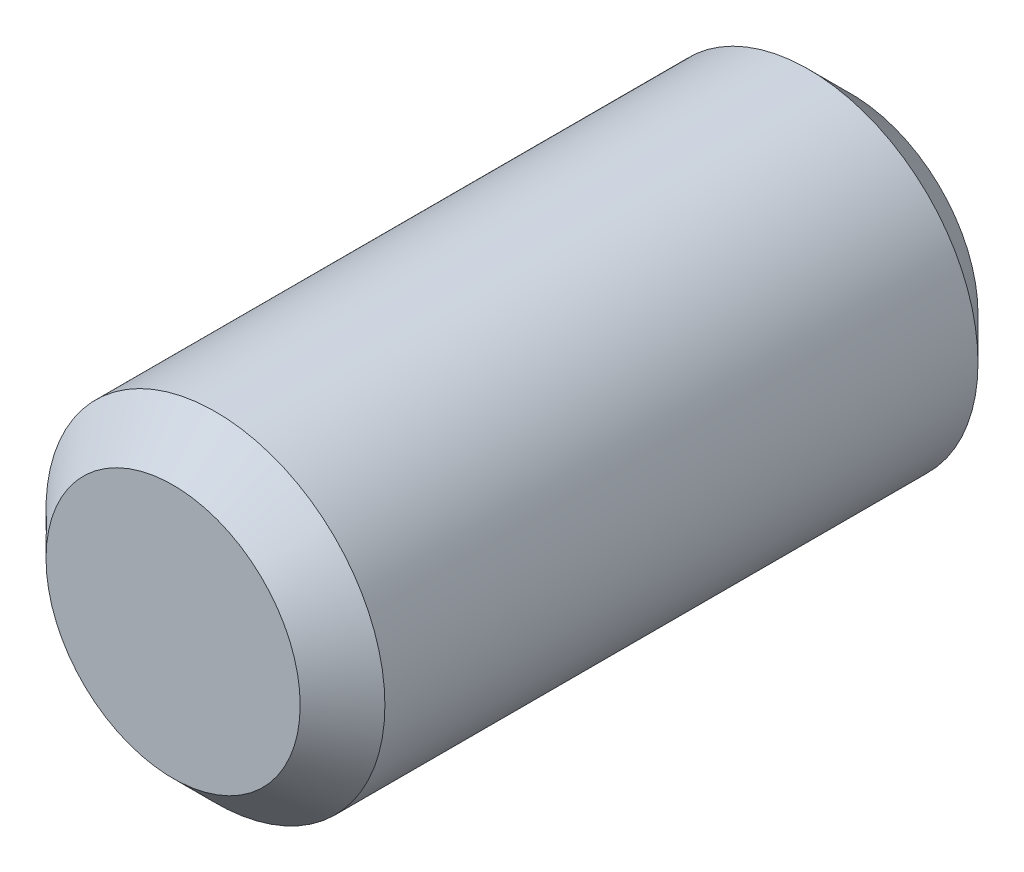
SolidWorks part; units mm, degrees
ref_plane "Plan de face" through (0, 0, 0) normal (0, 0, 1) x (1, 0, 0)
ref_plane "Plan de dessus" through (0, 0, 0) normal (0, 1, 0) x (1, 0, 0)
ref_plane "Plan de droite" through (0, 0, 0) normal (1, 0, 0) x (0, 0, -1)
sketch "Esquisse1" plane through (0, 0, 0) normal (0, 0, 1) x (1, 0, 0)
  circle A0 centre (0, 0) radius 2
  dimension "D1" = 4
extrude "Boss.-Extru.1" add sketch "Esquisse1" along normal blind 8
chamfer "Chanfrein1" distance 0.5 angle 45 2 edges at (2, 0, 0) (2, 0, 8)
sketch "Esquisse2" plane through (0, 0, 0) normal (0, 0, -1) x (-1, 0, 0)
  line L1 (1.1547, 0) -> (0.5774, 1)
  line L2 (0.5774, 1) -> (-0.5774, 1)
  line L3 (-0.5774, 1) -> (-1.1547, 0)
  line L4 (-1.1547, 0) -> (-0.5774, -1)
  line L5 (-0.5774, -1) -> (0.5774, -1)
  line L6 (0.5774, -1) -> (1.1547, 0)
  circle A0 centre (0, 0) radius 1 construction
  dimension "D1" = 2
extrude "Enlèv. mat.-Extru.1" cut sketch "Esquisse2" against normal blind 2
